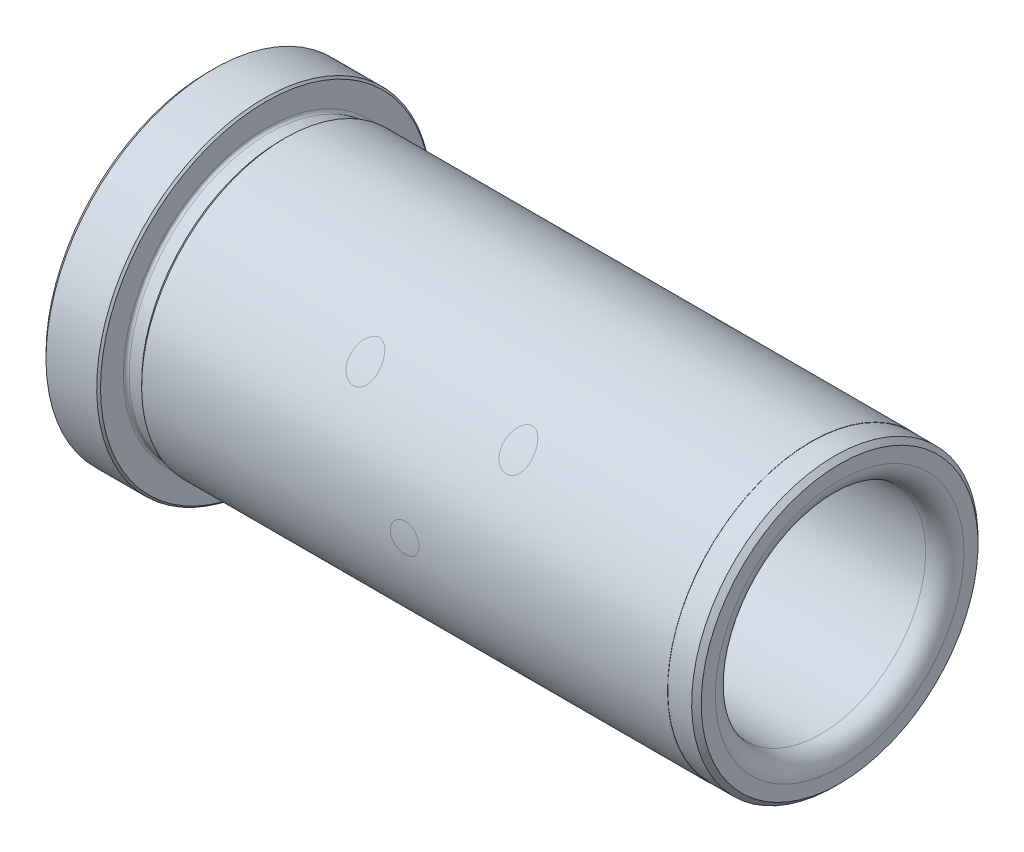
SolidWorks part; units mm, degrees
ref_plane "Front Plane" through (0, 0, 0) normal (0, 0, 1) x (1, 0, 0)
ref_plane "Top Plane" through (0, 0, 0) normal (0, 1, 0) x (1, 0, 0)
ref_plane "Right Plane" through (0, 0, 0) normal (1, 0, 0) x (0, 0, -1)
sketch "Sketch1" plane through (0, 0, 0) normal (0, 0, 1) x (1, 0, 0)
  line L0 (33, 14.975) -> (30, 14.975)
  line L1 (30, 15) -> (-25, 15)
  line L2 (30, 14.975) -> (30, 15)
  line L6 (-27, 17.5) -> (-27, 14.9)
  line L7 (-27, 17.5) -> (-33, 17.5)
  line L8 (-33, 17.5) -> (-33, 0)
  line L13 (33, 14.975) -> (33, 0)
  line L14 (33, 0) -> (-33, 0) construction
  line L15 (33, 0) -> (-33, 0)
  line L16 (-25, 15) -> (-25.4, 14.6)
  line L17 (-25.4, 14.6) -> (-26.7, 14.6)
  arc A0 (-26.7, 14.6) -> (-27, 14.9) centre (-26.7, 14.9) cw
  point P16 (0, 0)
  dimension "D5" = 0.025
  dimension "D1" = 0.3
  dimension "D2" = 135
  dimension "OD" = 30
  dimension "D3" = 0.4
  dimension "T" = 6
  dimension "HeadDia" = 35
  dimension "S" = 66
  dimension "HeadGap" = 2
  dimension "LeadLength" = 3
revolve "Revolve1" add sketch "Sketch1" angle 360 about L14
sketch "Sketch2" plane through (33, 0, 0) normal (1, 0, 0) x (0, 0, -1)
  circle A0 centre (0, 0) radius 11
  circle A1 centre (0, 0) radius 15 construction
  dimension "ID" = 22
extrude "Extrude1" cut sketch "Sketch2" against normal blind 66
sketch "Sketch4" [suppressed] plane through (-48, 0, 0) normal (1, 0, 0) x (0, 0, -1)
  circle A0 centre (0, 0) radius 21.01
  circle A2 centre (0, 0) radius 21 construction
  dimension "D1" = 0.01
extrude "Extrude3" [suppressed] cut sketch "Sketch4" against normal through all
fillet "Fillet2" radius 2 1 edges at (33, 11, 0)
chamfer "Chamfer5" distance 0.2 angle 45 1 edges at (-27, 17.5, 0)
chamfer "Chamfer3" distance 0.5 angle 45 1 edges at (33, 14.975, 0)
chamfer "Chamfer4" distance 0.5 angle 45 1 edges at (-33, 17.5, 0)
chamfer "Chamfer6" [suppressed] distance 0.5 angle 45
chamfer "Chamfer7" distance 0.5 angle 45 1 edges at (-33, 11, 0)
sketch "Sketch5" plane through (0, 0, 0) normal (0, 0, 1) x (1, 0, 0)
  line L0 (-25, 0) -> (30, 0) construction
  line L1 (-25, 15) -> (-25, -15) construction
  line L2 (30, -15) -> (30, 15) construction
  line L3 (2.5, 0) -> (2.5, 11.6457) construction
  circle A0 centre (2.5, 0) radius 1.5 construction
  circle A1 centre (-5.5, 10) radius 1.5
  circle A2 centre (10.5, 10) radius 1.5 construction
  circle A3 centre (-5.5, -10) radius 1.5 construction
  circle A4 centre (10.5, -10) radius 1.5 construction
  dimension "D1" = 3
  dimension "D2" = 8
  dimension "D3" = 10
sketch "Sketch6" plane through (0, 0, 0) normal (0, 0, 1) x (1, 0, 0)
  circle A0 centre (10.5, 10) radius 1.5 construction
  circle A1 centre (10.5, 10) radius 1.5
sketch "Sketch7" plane through (0, 0, 0) normal (0, 0, 1) x (1, 0, 0)
  circle A0 centre (-5.5, -10) radius 1.5 construction
  circle A1 centre (-5.5, -10) radius 1.5
sketch "Sketch8" plane through (0, 0, 0) normal (0, 0, 1) x (1, 0, 0)
  circle A0 centre (10.5, -10) radius 1.5 construction
  circle A1 centre (10.5, -10) radius 1.5
sketch "Sketch10" plane through (0, 0, 0) normal (0, 0, 1) x (1, 0, 0)
  circle A0 centre (2.5, 0) radius 1.5 construction
  circle A1 centre (2.5, 0) radius 1.5
